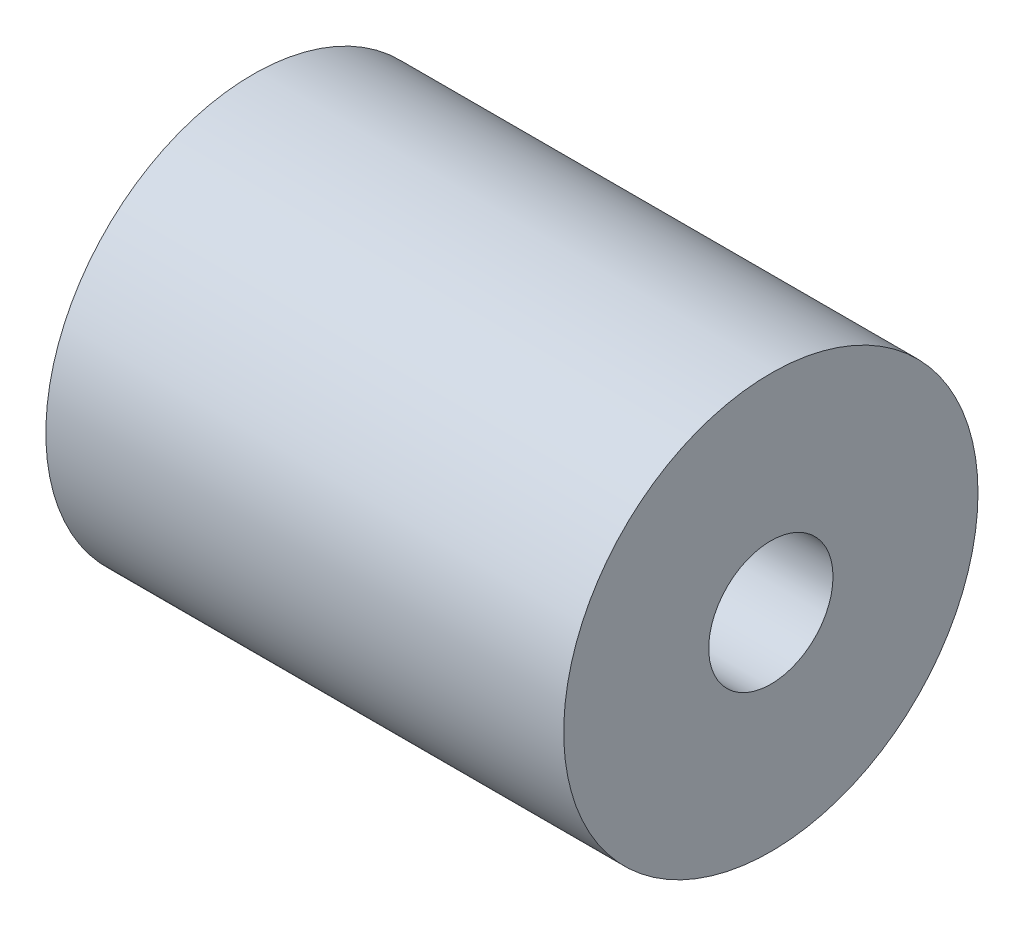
SolidWorks part; units mm, degrees
ref_plane "Front Plane" through (0, 0, 0) normal (0, 0, 1) x (1, 0, 0)
ref_plane "Top Plane" through (0, 0, 0) normal (0, 1, 0) x (1, 0, 0)
ref_plane "Right Plane" through (0, 0, 0) normal (1, 0, 0) x (0, 0, -1)
sketch "Sketch1" plane through (0, 0, 0) normal (1, 0, 0) x (0, 0, -1)
  circle A0 centre (0, 0) radius 3
  circle A1 centre (0, 0) radius 10
  dimension "D1" = 6
  dimension "D2" = 20
extrude "Boss-Extrude1" add sketch "Sketch1" along normal blind 25
